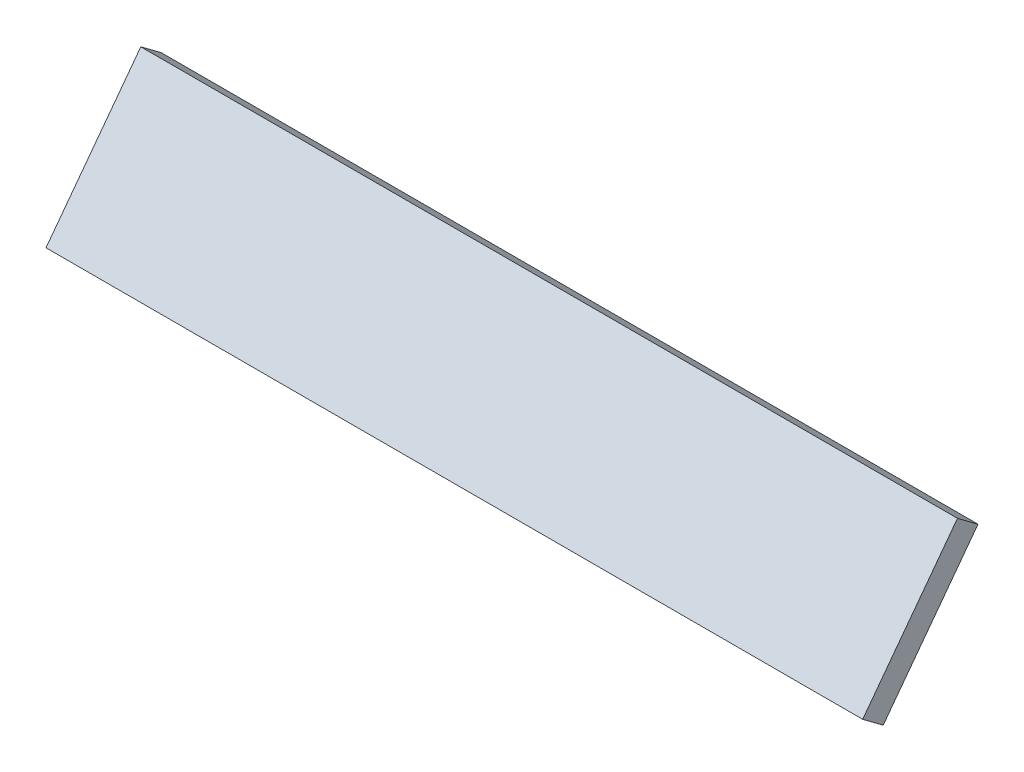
SolidWorks part; units mm, degrees
ref_plane "Front Plane" through (0, 0, 0) normal (0, 0, 1) x (1, 0, 0)
ref_plane "Top Plane" through (0, 0, 0) normal (0, 1, 0) x (1, 0, 0)
ref_plane "Right Plane" through (0, 0, 0) normal (1, 0, 0) x (0, 0, -1)
sketch3d "3DSketch1"
  line L0 (-711.2, -2478.5666, 140.7563) -> (812.8, -2478.5666, 140.7563) construction
  line L1 (-406.4, -2478.5666, 140.7563) -> (806.45, -2478.5666, 140.7563)
  line L2 (-406.4, -2478.5666, 140.7563) -> (-406.4, -2290.4465, 0)
  line L3 (-406.4, -2290.4465, 0) -> (806.45, -2290.4465, 0)
  line L4 (806.45, -2478.5666, 140.7563) -> (806.45, -2290.4465, 0)
  line L10 (-406.4, -2538.8773, 0) -> (-406.4, -2060.7883, 0) construction
  line L11 (-406.4, -2478.5666, 140.7563) -> (-406.4, -2455.7413, 171.2622)
  dimension "D1" = 234.95
  dimension "D2" = 6.35
  dimension "D3" = 38.1
extrude "Boss-Extrude1" add sketch "3DSketch1" along direction (0, 0.5991, 0.8007) on the side against the normal blind 38.1 contours L2 L3 L4 L1
